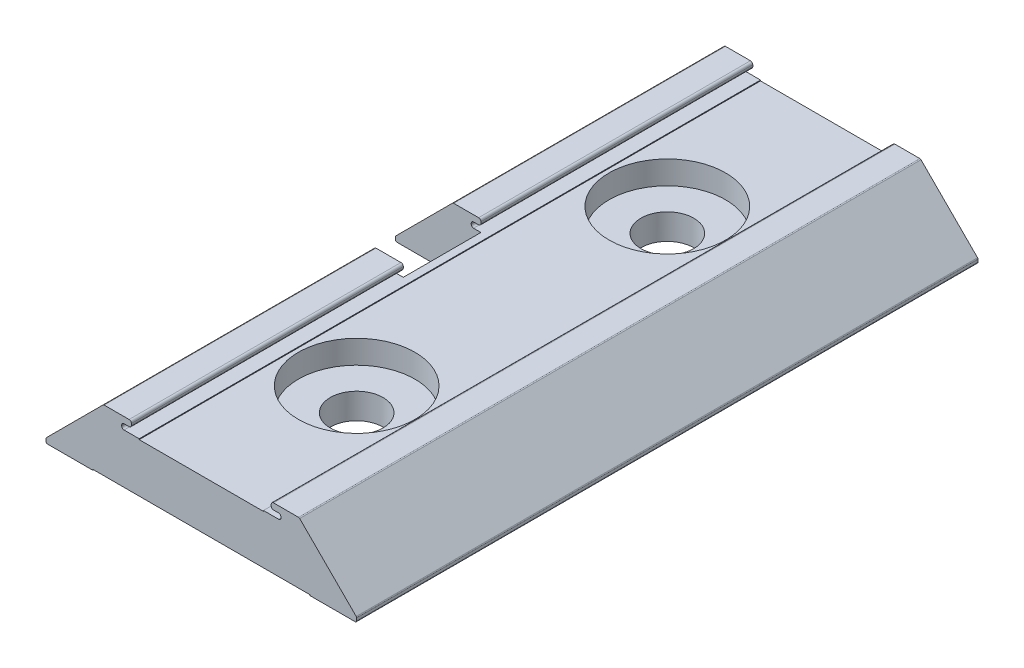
SolidWorks part; units mm, degrees
ref_plane "Front Plane" through (0, 0, 0) normal (0, 0, 1) x (1, 0, 0)
ref_plane "Top Plane" through (0, 0, 0) normal (0, 1, 0) x (1, 0, 0)
ref_plane "Right Plane" through (0, 0, 0) normal (1, 0, 0) x (0, 0, -1)
sketch "Sketch1" plane through (0, 0, 0) normal (0, 0, 1) x (1, 0, 0)
  line L0 (0.1, 0) -> (3, 0)
  line L1 (0, 0.1) -> (0, 0.2586)
  line L2 (0.0293, 0.3293) -> (3.6707, 3.9707)
  line L3 (3.7414, 4) -> (5.35, 4)
  line L4 (5.5, 3.85) -> (5.5, 3.75)
  line L5 (5.35, 3.6) -> (5.025, 3.6)
  line L6 (4.875, 3.45) -> (4.875, 3.4)
  line L7 (5.025, 3.25) -> (6, 3.25)
  line L8 (15.125, 3.4) -> (15.125, 3.45)
  line L9 (14.975, 3.6) -> (14.65, 3.6)
  line L10 (14.5, 3.75) -> (14.5, 3.85)
  line L11 (14.65, 4) -> (16.2586, 4)
  line L12 (16.3293, 3.9707) -> (19.9707, 0.3293)
  line L13 (20, 0.2586) -> (20, 0.1)
  line L14 (19.9, 0) -> (17, 0)
  line L15 (17, 0) -> (17, 0.05)
  line L16 (17, 0.05) -> (3, 0.05)
  line L17 (3, 0.05) -> (3, 0)
  line L18 (14, 3.25) -> (14.975, 3.25)
  line L19 (0, 0) -> (0.801, 0) construction
  line L20 (6, 3.25) -> (6, 3.2)
  line L21 (6, 3.2) -> (9.9, 3.2)
  line L22 (14, 3.25) -> (14, 3.2)
  line L23 (0, 0) -> (0, 0.3) construction
  line L24 (9.9, 3.2) -> (14, 3.2)
  line L25 (0, 0.3) -> (0.2634, 0.5634) construction
  arc A0 (5.025, 3.6) -> (4.875, 3.45) centre (5.025, 3.45) ccw
  arc A1 (5.025, 3.25) -> (4.875, 3.4) centre (5.025, 3.4) cw
  arc A2 (5.5, 3.75) -> (5.35, 3.6) centre (5.35, 3.75) cw
  arc A3 (5.35, 4) -> (5.5, 3.85) centre (5.35, 3.85) cw
  arc A4 (15.125, 3.4) -> (14.975, 3.25) centre (14.975, 3.4) cw
  arc A5 (14.975, 3.6) -> (15.125, 3.45) centre (14.975, 3.45) cw
  arc A6 (14.5, 3.75) -> (14.65, 3.6) centre (14.65, 3.75) ccw
  arc A7 (14.65, 4) -> (14.5, 3.85) centre (14.65, 3.85) ccw
  arc A8 (20, 0.1) -> (19.9, 0) centre (19.9, 0.1) cw
  arc A9 (19.9707, 0.3293) -> (20, 0.2586) centre (19.9, 0.2586) cw
  arc A10 (16.3293, 3.9707) -> (16.2586, 4) centre (16.2586, 3.9) ccw
  arc A11 (3.6707, 3.9707) -> (3.7414, 4) centre (3.7414, 3.9) cw
  arc A12 (0.0293, 0.3293) -> (0, 0.2586) centre (0.1, 0.2586) ccw
  arc A13 (0.1, 0) -> (0, 0.1) centre (0.1, 0.1) cw
  point P42 (20, 0)
  point P45 (20, 0.3)
  point P52 (0, 0.3)
  point P55 (0, 0)
  dimension "D17" = 0.15
  dimension "D19" = 3.2
  dimension "D24" = 0.1
  dimension "D1" = 20
  dimension "D2" = 3
  dimension "D3" = 3
  dimension "D4" = 0.3
  dimension "D5" = 0.3
  dimension "D6" = 0.05
  dimension "D7" = 4
  dimension "D8" = 4
  dimension "D9" = 10.25
  dimension "D10" = 4.875
  dimension "D11" = 0.75
  dimension "D12" = 0.35
  dimension "D13" = 0.35
  dimension "D14" = 9
  dimension "D15" = 0.625
  dimension "D16" = 135
  dimension "D18" = 4.875
  dimension "D20" = 0.625
  dimension "D21" = 8
  dimension "D22" = 6
  dimension "D23" = 0.05
extrude "Extrude1" add sketch "Sketch1" along normal blind 40
hole_wizard "CBORE for M3 Hex Socket Head Cap Screw1" positions "Sketch5" profile "Sketch4" counterbore size "M3" standard "DIN"
sketch "Sketch5" plane through (0, 3.2, 0) normal (0, 1, 0) x (-1, 0, 0)
  line L0 (-14, 0) -> (-6, 0) construction
  line L1 (0, 40) -> (0, 0) construction
  point P0 (-10, 10)
  dimension "D1" = 10
  dimension "D2" = 10
sketch "Sketch4" plane through (10, 3.2, 10) normal (1, 0, 0) x (0, 0, 1)
  line L0 (0, 0) -> (0, 3.2)
  line L1 (0, 3.2) -> (1.7, 3.2)
  line L3 (1.7, 3.2) -> (1.7, 1.5)
  line L4 (1.7, 1.5) -> (3.75, 1.5)
  line L5 (3.75, 1.5) -> (3.75, 0)
  line L7 (3.75, 0) -> (0, 0)
  line L11 (0, -6.35) -> (0, 107.95) construction
  dimension "Thru Hole Dia." = 3.4
  dimension "Thru Hole Depth" = 3.2
  dimension "C'Bore Dia." = 7.5
  dimension "C'Bore Depth" = 1.5
pattern_linear "LPattern1" count 2 spacing 20 along (0, 0, 1) of "CBORE for M3 Hex Socket Head Cap Screw1"
sketch "Sketch6" plane through (0, 0, 0) normal (-1, 0, 0) x (0, 0, 1)
  line L0 (0, 3.9707) -> (0, 0.3293) construction
  line L1 (17.5, 7.833) -> (22.5, 7.833)
  line L2 (17.5, 7.833) -> (17.5, -4.2353)
  line L3 (17.5, -4.2353) -> (22.5, -4.2353)
  line L4 (22.5, 7.833) -> (22.5, -4.2353)
  dimension "D1" = 17.5
  dimension "D2" = 5
extrude "Extrude2" cut sketch "Sketch6" against normal blind 5.5
hole_wizard "M1.6 Tapped Hole1" positions "Sketch8" profile "Sketch7" tap size "M1.6" standard "DIN"
sketch "Sketch8" plane through (5.5, 0, 0) normal (-1, 0, 0) x (0, 0, 1)
  line L0 (40, 0) -> (0, 0) construction
  line L1 (0, 3.9707) -> (0, 0.3293) construction
  point P0 (20, 1.75)
  dimension "D1" = 1.75
  dimension "D2" = 20
sketch "Sketch7" plane through (5.5, 1.75, 20) normal (0, 1, 0) x (0, 0, 1)
  line L0 (0, 0) -> (0, 6.4255)
  line L1 (0, 6.4255) -> (0.625, 6.05)
  line L2 (0.625, 6.05) -> (0.625, 0)
  line L5 (0.625, 0) -> (0, 0)
  line L10 (0, 6.4255) -> (-0.625, 6.05) construction
  line L11 (0, -6.35) -> (0, 107.95) construction
  dimension "Tap Drill Dia." = 1.25
  dimension "Tap Drill Depth" = 6.05
  dimension "Drill Angle" = 118
